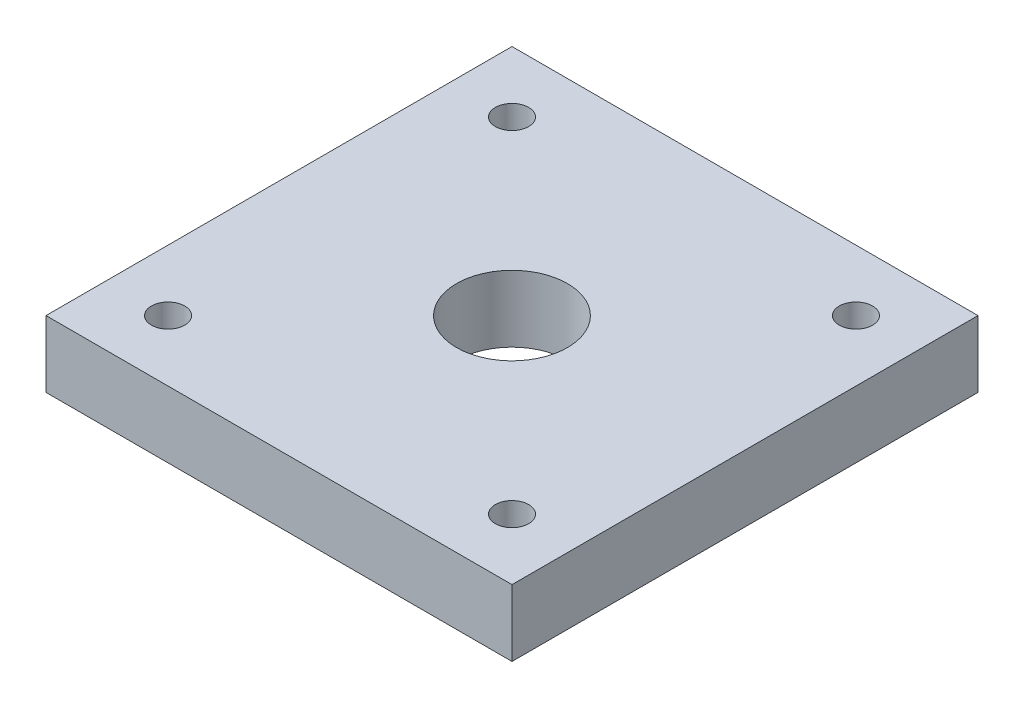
SolidWorks part; units mm, degrees
ref_plane "Front" through (0, 0, 0) normal (0, 0, 1) x (1, 0, 0)
ref_plane "Top" through (0, 0, 0) normal (0, 1, 0) x (1, 0, 0)
ref_plane "Right" through (0, 0, 0) normal (1, 0, 0) x (0, 0, -1)
sketch "Sketch1" plane through (0, 0, 0) normal (0, 1, 0) x (1, 0, 0)
  line L1 (0, 0) -> (42, 0)
  line L2 (0, 0) -> (0, 42)
  line L3 (0, 42) -> (42, 42)
  line L4 (42, 0) -> (42, 42)
  circle A0 centre (5.5, 36.5) radius 1.5
  circle A1 centre (36.5, 36.5) radius 1.5
  circle A2 centre (36.5, 5.5) radius 1.5
  circle A3 centre (5.5, 5.5) radius 1.5
  circle A4 centre (21, 21) radius 5
  dimension "D3" = 3
  dimension "D4" = 3
  dimension "D5" = 3
  dimension "D6" = 3
  dimension "D13" = 10
  dimension "D14" = 21
  dimension "D1" = 42
  dimension "D2" = 42
  dimension "D7" = 31
  dimension "D8" = 31
  dimension "D9" = 31
  dimension "D10" = 31
  dimension "D11" = 5.5
  dimension "D12" = 5.5
  dimension "D15" = 21
extrude "Boss-Extrude1" add sketch "Sketch1" along normal blind 6
